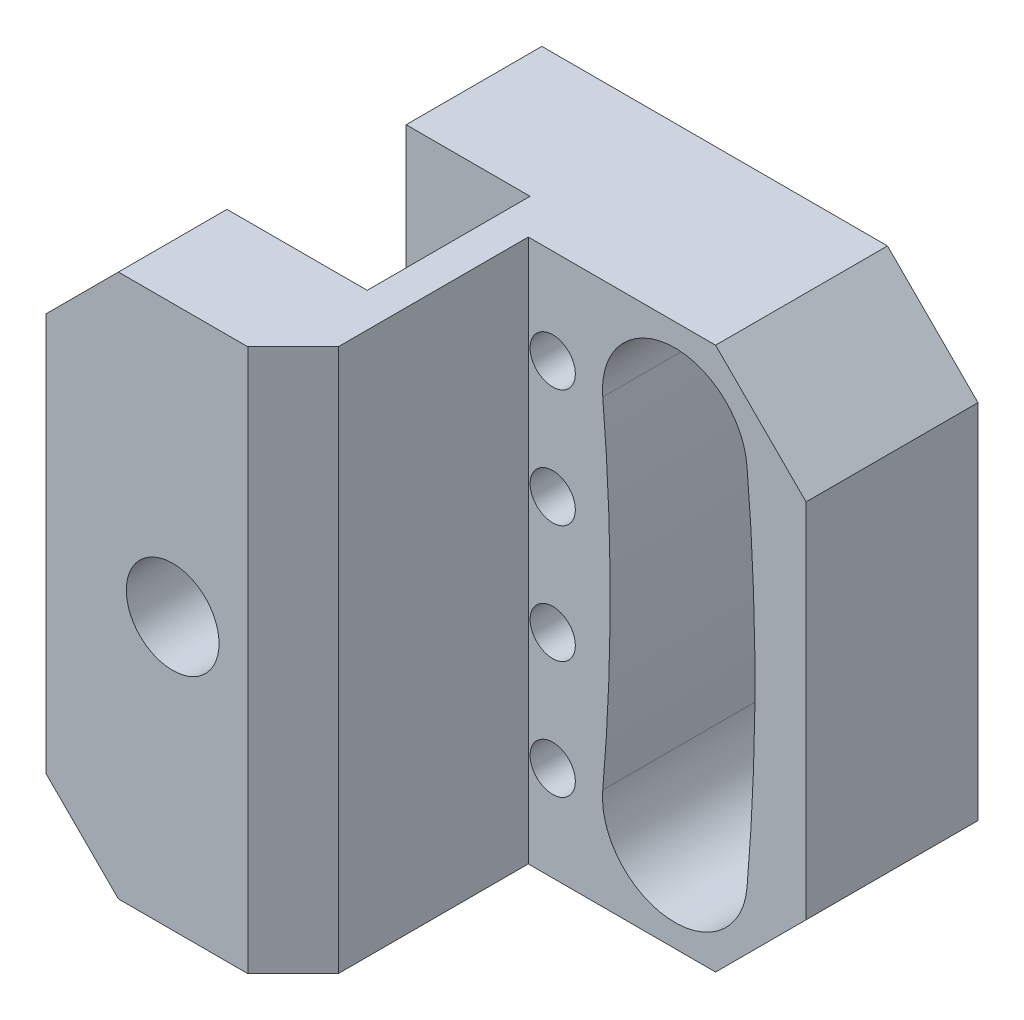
SolidWorks part; units mm, degrees
ref_plane "Plan1" through (0, 0, 0) normal (0, 0, 1) x (1, 0, 0)
ref_plane "Plan2" through (0, 0, 0) normal (0, 1, 0) x (1, 0, 0)
ref_plane "Plan3" through (0, 0, 0) normal (1, 0, 0) x (0, 0, -1)
sketch "Esquisse1" plane through (0, 0, 0) normal (0, 0, 1) x (1, 0, 0)
  line L0 (10, 0) -> (60, 0)
  line L1 (60, 0) -> (60, 50)
  line L2 (50, 60) -> (10, 60)
  line L3 (0, 50) -> (0, 10)
  line L4 (50, 60) -> (60, 50)
  line L6 (0, 10) -> (10, 0)
  line L7 (0, 50) -> (10, 60)
  dimension "D1" = 10
  dimension "D2" = 60
  dimension "D3" = 10
  dimension "D4" = 60
  dimension "D5" = 10
  dimension "D6" = 10
  dimension "D7" = 10
extrude "Base-Extrusion" add sketch "Esquisse1" along normal blind 45
sketch "Esquisse2" plane through (0, 0, 0) normal (0, -1, 0) x (1, 0, 0)
  line L0 (60, 38.8) -> (29.3, 38.8)
  line L2 (29.3, 38.8) -> (29.3, 19)
  line L3 (29.3, 19) -> (60, 19)
  line L4 (60, 19) -> (60, 38.8)
  line L6 (10, 45) -> (60, 45) construction
  line L7 (10, 0) -> (60, 0) construction
  line L8 (60, 45) -> (60, 0) construction
  dimension "D1" = 30.7
  dimension "D2" = 6.2
  dimension "D3" = 19
extrude "Enlèv. mat.-Extru.1" cut sketch "Esquisse2" against normal through all
sketch "Esquisse3" plane through (0, 0, 45) normal (0, 0, 1) x (1, 0, 0)
  line L0 (50, 60) -> (10, 60) construction
  line L2 (60, 0) -> (60, 50) construction
  circle A0 centre (45.6, 30) radius 10.25
  dimension "D1" = 20.5
  dimension "D2" = 30
  dimension "D3" = 14.4
extrude "Enlèv. mat.-Extru.2" cut sketch "Esquisse3" against normal up to next
sketch "Esquisse4" plane through (0, 0, 0) normal (0, 0, -1) x (-1, 0, 0)
  line L0 (-37.5, 10.5) -> (-37.5, 49.5) construction
  line L1 (-53.5, 10.5) -> (-53.5, 49.5) construction
  line L2 (-60, 0) -> (-60, 50) construction
  line L3 (-10, 0) -> (-60, 0) construction
  line L4 (-37.5, 30) -> (178.6534, 30) construction
  arc A0 (-37.5, 10.5) -> (-53.5, 10.5) centre (-45.5, 10.5) cw construction
  arc A1 (-53.5, 49.5) -> (-37.5, 49.5) centre (-45.5, 49.5) cw construction
  arc A2 (-37.5301, 48.8067) -> (-53.4699, 50.1933) centre (-45.5, 49.5) ccw
  arc A3 (-53.4699, 9.8067) -> (-37.5301, 11.1933) centre (-45.5, 10.5) ccw
  arc A4 (-53.4699, 50.1933) -> (-53.4699, 9.8067) centre (178.6534, 30) ccw
  arc A5 (-37.5301, 48.8067) -> (-37.5301, 11.1933) centre (178.6534, 30) ccw
  circle A6 centre (178.6534, 30) radius 225 construction
  dimension "D5" = 450
  dimension "D1" = 16
  dimension "D2" = 14.5
  dimension "D3" = 39
  dimension "D4" = 10.5
extrude "Enlèv. mat.-Extru.3" cut sketch "Esquisse4" against normal up to next
chamfer "Chanfrein1" distance 2 angle 45 1 edges at (0, 30, 45)
ref_plane "Plan4" through (0, 0, 15) normal (0, 0, 1) x (1, 0, 0)
hole_wizard "Dégagement M61" positions "Esquisse14" profile "Esquisse13" hole size "M6" standard "Ansi Métrique"
sketch "Esquisse14" plane through (0, 0, 45) normal (0, 0, 1) x (1, 0, 0)
  line L0 (50, 60) -> (10, 60) construction
  line L1 (60, 0) -> (60, 50) construction
  point P0 (32, 49.5)
  point P1 (32, 36.5)
  point P2 (32, 23.5)
  point P3 (32, 10.5)
  dimension "D1" = 13
  dimension "D2" = 10.5
  dimension "D3" = 13
  dimension "D4" = 13
  dimension "D5" = 28
sketch "Esquisse13" plane through (32, 49.5, 45) normal (1, 0, 0) x (0, -1, 0)
  line L0 (0, 0) -> (0, 38.5022)
  line L1 (0, 38.5022) -> (2.5, 37)
  line L2 (2.5, 37) -> (2.5, 0)
  line L5 (2.5, 0) -> (0, 0)
  line L10 (0, 38.5022) -> (-2.5, 37) construction
  line L11 (0, -6.35) -> (0, 107.95) construction
  dimension "Diamètre du perçage" = 5
  dimension "Profondeur du perçage" = 37
  dimension "Angle de pointe" = 118
sketch "Esquisse15" plane through (0, 0, 45) normal (0, 0, 1) x (1, 0, 0)
  line L0 (0, 32) -> (2, 30)
  line L1 (0, 10) -> (0, 50) construction
  line L2 (2, 52) -> (2, 8) construction
  line L3 (2, 30) -> (0, 28)
  line L4 (0, 32) -> (0, 28)
  dimension "D1" = 30
  dimension "D2" = 45
extrude "Enlèv. mat.-Extru.7" cut sketch "Esquisse15" against normal through all
sketch "Esquisse16" plane through (0, 0, 45) normal (0, 0, 1) x (1, 0, 0)
  line L0 (60, 0) -> (60, 50) construction
  line L1 (29.3, 60) -> (60, 60)
  line L2 (29.3, 60) -> (29.3, 0)
  line L3 (29.3, 0) -> (60, 0)
  line L4 (60, 60) -> (60, 0)
  line L5 (10, 0) -> (60, 0) construction
extrude "Enlèv. mat.-Extru.8" cut sketch "Esquisse16" against normal up to next
chamfer "Chanfrein2" distance 5 angle 45 1 edges at (29.3, 30, 45)
sketch "Esquisse17" plane through (0, 0, 0) normal (0, 0, -1) x (-1, 0, 0)
  line L0 (288.69, 30) -> (-238.3018, 30) construction
  line L1 (288.69, 30) -> (479.1394, 30) construction
  line L2 (28.6881, 56.2) -> (-74.1804, 56.2) construction
  line L3 (42.0294, 3.8) -> (-92.437, 3.8) construction
  line L5 (0, 50) -> (0, 32) construction
  arc A1 (-35.7936, 56.3224) -> (-35.7936, 3.6776) centre (393.4, 30) ccw
  arc A2 (-31.8011, 56.0776) -> (-31.8011, 3.9224) centre (393.4, 30) ccw
  circle A3 centre (393.4, 30) radius 428 construction
  arc A5 (-31.8011, 56.0776) -> (-35.7936, 56.3224) centre (-33.7973, 56.2) ccw
  arc A6 (-35.7936, 3.6776) -> (-31.8011, 3.9224) centre (-33.7973, 3.8) ccw
  point P5 (0, 41)
  dimension "D1" = 856
  dimension "D2" = 860
  dimension "D4" = 393.4
  dimension "D5" = 26.2
  dimension "D7" = 4
  dimension "D8" = 4
  dimension "D3" = 852
  dimension "D6" = 26.2
extrude "Enlèv. mat.-Extru.11" cut sketch "Esquisse17" against normal blind 5
sketch "Esquisse18" plane through (0, 0, 0) normal (0, 0, -1) x (-1, 0, 0)
  line L0 (-127.6434, 30) -> (393.4, 30) construction
  line L1 (0, 50) -> (0, 32) construction
  arc A0 (-31.8011, 56.0776) -> (-31.8011, 3.9224) centre (393.4, 30) ccw construction
  arc A1 (-29.1286, 56.3653) -> (-29.1286, 3.6347) centre (288.78, 30) ccw
  arc A2 (-25.1423, 56.0347) -> (-25.1423, 3.9653) centre (288.78, 30) ccw
  circle A3 centre (288.78, 30) radius 317 construction
  arc A5 (-25.1423, 56.0347) -> (-29.1286, 56.3653) centre (-27.1354, 56.2) ccw
  arc A6 (-29.1286, 3.6347) -> (-25.1423, 3.9653) centre (-27.1354, 3.8) ccw
  arc A7 (-18.6805, 55.9929) -> (-18.6805, 4.0071) centre (230.97, 30) ccw
  arc A8 (-22.659, 56.4071) -> (-22.659, 3.5929) centre (230.97, 30) ccw
  circle A9 centre (230.97, 30) radius 253 construction
  arc A10 (-18.6805, 55.9929) -> (-22.659, 56.4071) centre (-20.6697, 56.2) ccw
  arc A11 (-22.659, 3.5929) -> (-18.6805, 4.0071) centre (-20.6697, 3.8) ccw
  arc A12 (-16.3422, 56.466) -> (-16.3422, 3.534) centre (180.89, 30) ccw
  arc A13 (-12.3778, 55.934) -> (-12.3778, 4.066) centre (180.89, 30) ccw
  circle A14 centre (180.89, 30) radius 197 construction
  arc A15 (-12.3778, 55.934) -> (-16.3422, 56.466) centre (-14.36, 56.2) ccw
  arc A16 (-16.3422, 3.534) -> (-12.3778, 4.066) centre (-14.36, 3.8) ccw
  dimension "D1" = 638
  dimension "D2" = 634
  dimension "D3" = 630
  dimension "D4" = 16.11
  dimension "D5" = 26.2
  dimension "D7" = 4
  dimension "D8" = 4
  dimension "D9" = 506
  dimension "D10" = 510
  dimension "D11" = 502
  dimension "D12" = 22.03
  dimension "D15" = 4
  dimension "D16" = 4
  dimension "D17" = 394
  dimension "D18" = 398
  dimension "D19" = 390
  dimension "D20" = 28.22
  dimension "D23" = 4
  dimension "D24" = 4
  dimension "D6" = 26.2
  dimension "D13" = 26.2
  dimension "D14" = 26.2
  dimension "D21" = 26.2
  dimension "D22" = 26.2
extrude "Enlèv. mat.-Extru.12" cut sketch "Esquisse18" against normal blind 5
hole_wizard "Diamètre du perçage Ø4.2 (4.2)1" positions "Esquisse25" profile "Esquisse24" hole size "Ø4.2" standard "ISO"
sketch "Esquisse25" plane through (4.2668, 0, -4.4656) normal (0, 1, 0) x (-1, 0, 0)
  line L0 (-20.0332, 49.4656) -> (-5.7332, 49.4656) construction
  line L1 (4.2668, 47.4656) -> (4.2668, 4.4656) construction
  point P0 (-11.7332, 42.9656)
  dimension "D1" = 6.5
  dimension "D2" = 16
sketch "Esquisse24" plane through (16, 0, 38.5) normal (1, 0, 0) x (0, 0, -1)
  line L0 (0, 0) -> (0, 15.2124)
  line L1 (0, 15.2124) -> (2.1, 14)
  line L2 (2.1, 14) -> (2.1, 0)
  line L5 (2.1, 0) -> (0, 0)
  line L10 (0, 15.2124) -> (-2.1, 14) construction
  line L11 (0, -6.35) -> (0, 107.95) construction
  dimension "Diamètre du perçage" = 4.2
  dimension "Profondeur du perçage" = 14
  dimension "Angle de pointe" = 120
sketch "Esquisse26" plane through (0, 0, 0) normal (0, -1, 0) x (1, 0, 0)
  line L0 (60, 19) -> (60, 0) construction
  line L1 (0, 0) -> (11.8, 0)
  line L2 (0, 0) -> (0, 15)
  line L3 (0, 15) -> (11.8, 15)
  line L4 (11.8, 0) -> (11.8, 15)
  line L5 (0, 0) -> (10, 0) construction
  dimension "D1" = 48.2
  dimension "D2" = 15
extrude "Enlèv. mat.-Extru.13" cut sketch "Esquisse26" against normal through all
sketch "Esquisse27" plane through (0, 0, 0) normal (0, -1, 0) x (1, 0, 0)
  line L0 (11.8, 0) -> (60, 0) construction
  line L1 (0, 15) -> (25.5, 15)
  line L2 (0, 15) -> (0, 33)
  line L3 (0, 33) -> (25.5, 33)
  line L4 (25.5, 15) -> (25.5, 33)
  line L5 (60, 19) -> (60, 0) construction
  dimension "D1" = 33
  dimension "D2" = 34.5
extrude "Enlèv. mat.-Extru.14" cut sketch "Esquisse27" against normal through all
hole_wizard "Diamètre du perçage Ø10.2 (10.25)1" positions "Esquisse12" profile "Esquisse11" hole size "Ø10.2" standard "Ansi Metric"
sketch "Esquisse12" plane through (0, 0, 45) normal (0, 0, 1) x (1, 0, 0)
  line L0 (24.3, 60) -> (10, 60) construction
  line L2 (60, 50) -> (60, 0) construction
  point P0 (16, 30)
  dimension "D1" = 30
  dimension "D2" = 44
sketch "Esquisse11" plane through (16, 30, 45) normal (1, 0, 0) x (0, -1, 0)
  line L0 (0, 0) -> (0, 12)
  line L1 (0, 12) -> (5.125, 12)
  line L2 (5.125, 12) -> (5.125, 0)
  line L5 (5.125, 0) -> (0, 0)
  line L11 (0, -6.35) -> (0, 107.95) construction
  dimension "Diamètre du perçage jusqu'au prochain" = 10.25
  dimension "Profondeur du perçage jusqu'au prochain" = 12
thread "Filetage1" pitch 1.75 start angle 0, offset 5, length 25, pitch 1.75, diameter 10.25
ref_plane "Plan5" through (10.875, 30, 50) normal (0, -1, 0) x (-1, 0, 0)
sketch "Profil de filetage1" plane through (10.875, 30, 50) normal (0, -1, 0) x (-1, 0, 0)
  line L0 (0, 0) -> (0, 1.75) construction
  line L1 (0, 0) -> (0.9472, 0.5469)
  line L2 (0.9472, 0.5469) -> (0.9472, 0.7656)
  line L3 (0.9472, 0.7656) -> (0, 1.3125)
  line L4 (0.9472, 0.6562) -> (0, 0.6562) construction
  line L11 (0, 0) -> (0, 1.3125)
  point P2 (0, 0)
  dimension "Pitch" = 1.75
  dimension "Profile_Angle" = 60
  dimension "Profile_Land" = 0.2188
  dimension "Profile_Height" = 0.9472
chamfer "Chanfrein3" distance 10 angle 45 1 edges at (60, 0, 9.5)
thread "Filetage2" pitch 0.8 start angle 0, offset 2, length 12, pitch 0.8, diameter 4.2
ref_plane "Plan6" through (18.1, -2, 38.5) normal (0, 0, 1) x (1, 0, 0)
sketch "Profil de filetage2" plane through (18.1, -2, 38.5) normal (0, 0, 1) x (1, 0, 0)
  line L0 (0, 0) -> (0, 0.8) construction
  line L1 (0, 0) -> (0.433, 0.25)
  line L2 (0.433, 0.25) -> (0.433, 0.35)
  line L3 (0.433, 0.35) -> (0, 0.6)
  line L4 (0.433, 0.3) -> (0, 0.3) construction
  line L11 (0, 0) -> (0, 0.6)
  point P2 (0, 0)
  dimension "Pitch" = 0.8
  dimension "Profile_Angle" = 60
  dimension "Profile_Land" = 0.1
  dimension "Profile_Height" = 0.433
